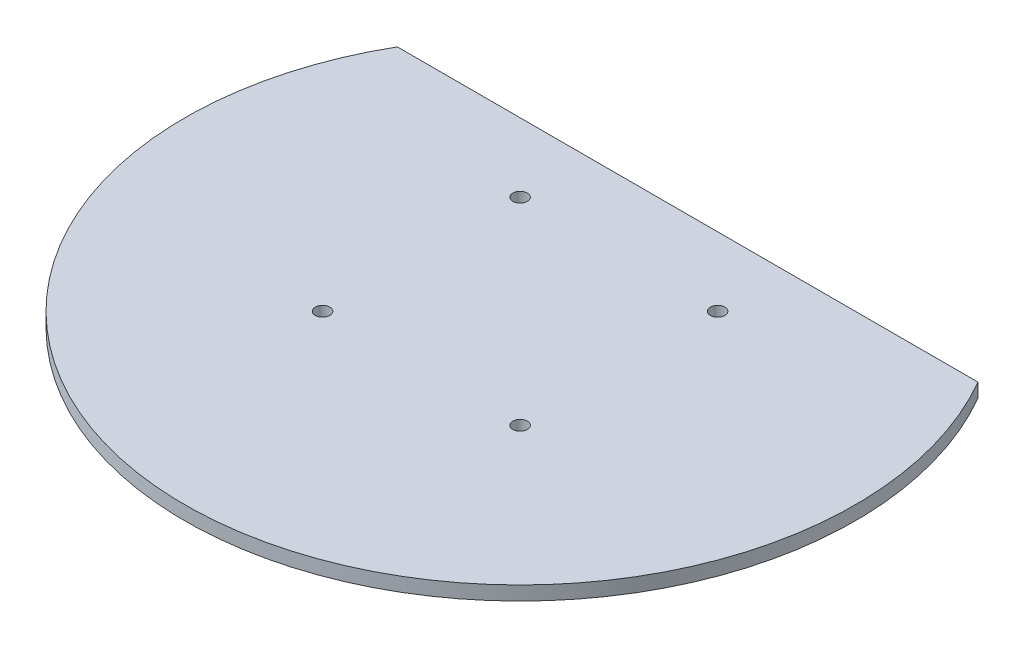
SolidWorks part; units mm, degrees
ref_plane "Front Plane" through (0, 0, 0) normal (0, 0, 1) x (1, 0, 0)
ref_plane "Top Plane" through (0, 0, 0) normal (0, 1, 0) x (1, 0, 0)
ref_plane "Right Plane" through (0, 0, 0) normal (1, 0, 0) x (0, 0, -1)
sketch "Sketch1" plane through (0, 0, 0) normal (0, 1, 0) x (1, 0, 0)
  line L3 (-131.9823, 76.2) -> (131.9823, 76.2)
  arc A2 (-131.9823, 76.2) -> (131.9823, 76.2) centre (0, 0) ccw
  dimension "D1" = 152.4
  dimension "D2" = 76.2
extrude "Extrude1" add sketch "Sketch1" along normal blind 6.35
sketch "Sketch2" plane through (0, 6.35, 0) normal (0, 1, 0) x (1, 0, 0)
  line L0 (0, 0) -> (-44.9013, 44.9013)
  line L1 (0, 76.2) -> (0, -152.4) construction
  line L2 (131.9823, 76.2) -> (-131.9823, 76.2) construction
  circle A2 centre (-44.9013, 44.9013) radius 3.302
  circle A3 centre (44.9013, 44.9013) radius 3.302
  circle A4 centre (44.9013, -44.9013) radius 3.302
  circle A5 centre (-44.9013, -44.9013) radius 3.302
  arc A6 (-131.9823, 76.2) -> (131.9823, 76.2) centre (0, 0) ccw construction
  dimension "D1" = 45
extrude "Extrude2" cut sketch "Sketch2" against normal blind 6.35 contours A2 | A5 | A3 | A4
